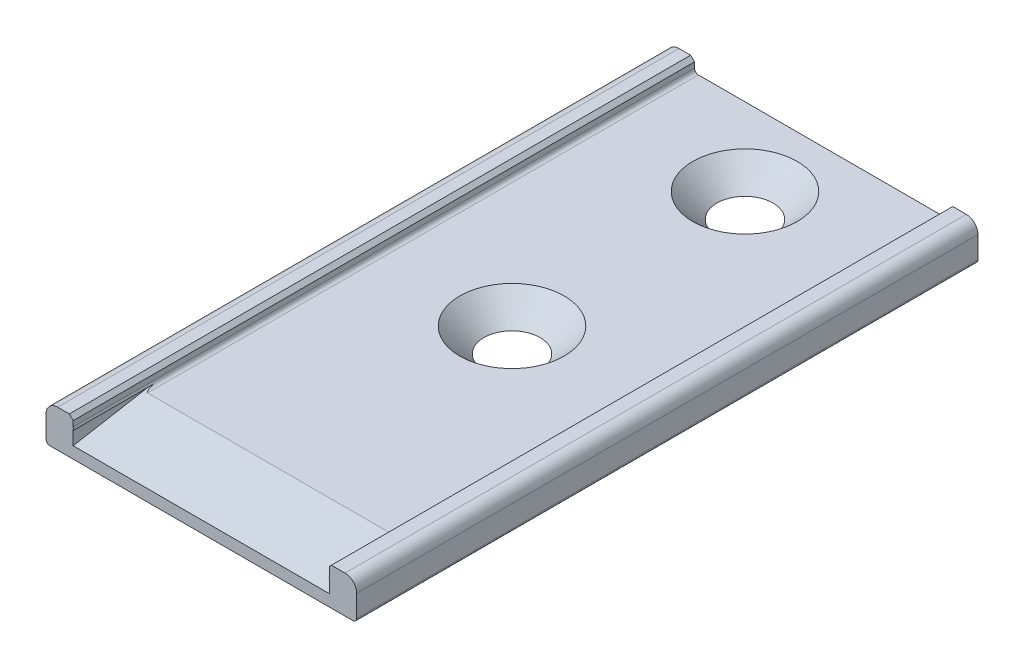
SolidWorks part; units mm, degrees
ref_plane "Front Plane" through (0, 0, 0) normal (0, 0, 1) x (1, 0, 0)
ref_plane "Top Plane" through (0, 0, 0) normal (0, 1, 0) x (1, 0, 0)
ref_plane "Right Plane" through (0, 0, 0) normal (1, 0, 0) x (0, 0, -1)
sketch "Sketch1" plane through (0, 0, 0) normal (0, 0, 1) x (1, 0, 0)
  line L0 (36.75, 4.8) -> (38.5, 4.8)
  line L1 (0.5, 0) -> (39.5, 0)
  line L2 (0, 0.5) -> (0, 3.3)
  line L3 (1.5, 4.8) -> (3, 4.8)
  line L4 (40, 0.5) -> (40, 3.3)
  line L6 (3.5, 4.3) -> (3.5, 3.6)
  line L7 (4, 3.1) -> (36, 3.1)
  line L8 (36.5, 4.55) -> (36.5, 3.6)
  line L9 (3, 4.8) -> (3.5, 4.3)
  line L10 (36.75, 4.8) -> (36.5, 4.55)
  arc A0 (38.5, 4.8) -> (40, 3.3) centre (38.5, 3.3) cw
  arc A1 (0, 3.3) -> (1.5, 4.8) centre (1.5, 3.3) cw
  arc A2 (39.5, 0) -> (40, 0.5) centre (39.5, 0.5) ccw
  arc A3 (0, 0.5) -> (0.5, 0) centre (0.5, 0.5) ccw
  arc A4 (36.5, 3.6) -> (36, 3.1) centre (36, 3.6) cw
  arc A5 (3.5, 3.6) -> (4, 3.1) centre (4, 3.6) ccw
  point P9 (3.5, 4.8)
  point P10 (36.5, 4.8)
  point P14 (0, 4.8)
  point P20 (40, 0)
  point P23 (0, 0)
  dimension "D6" = 1.5
  dimension "D2" = 0.5
  dimension "D7" = 0.5
  dimension "D1" = 40
  dimension "D3" = 3.5
  dimension "D4" = 4.8
  dimension "D5" = 3.1
  dimension "D10" = 33
extrude "Boss-Extrude1" add sketch "Sketch1" against normal blind 80
sketch "Sketch2" plane through (0, 0, 0) normal (0, 0, 1) x (1, 0, 0)
  line L0 (0.5, 0) -> (39.5, 0) construction
  line L1 (16, 0) -> (24, 0)
  line L2 (16, 0) -> (16, -2.75)
  line L3 (16.25, -3) -> (23.75, -3)
  line L4 (24, 0) -> (24, -2.75)
  line L5 (20, -3) -> (20, 4.8258) construction
  line L6 (0, 3.3) -> (0, 0.5) construction
  line L7 (16, -2.75) -> (16.25, -3)
  line L8 (23.75, -3) -> (24, -2.75)
  line L9 (40, 0.5) -> (40, 3.3) construction
  line L10 (38.5, 4.8) -> (36.75, 4.8) construction
  point P1 (24, -3)
  point P2 (16, -3)
  dimension "D1" = 3
  dimension "D2" = 8
  dimension "D3" = 4
  dimension "D4" = 20
extrude "Boss-Extrude2" [suppressed] add sketch "Sketch2" against normal through all
hole_wizard "CSK for M6 Hex Socket Countersunk Cap Screw1" positions "Sketch3" profile "Sketch4" countersink size "M6" standard "ISO"
sketch "Sketch3" plane through (0, 3.1, 0) normal (0, 1, 0) x (1, 0, 0)
  line L0 (0, 80) -> (0, 0) construction
  line L2 (36, 0) -> (4, 0) construction
  point P0 (20, 40)
  point P10 (20, 70)
  dimension "D1" = 20
  dimension "D2" = 40
  dimension "D3" = 30
sketch "Sketch4" plane through (20, 3.1, -40) normal (1, 0, 0) x (0, 0, 1)
  line L0 (0, 0) -> (0, 39.9828)
  line L1 (0, 39.9828) -> (3.3, 38)
  line L2 (3.3, 38) -> (3.3, 3.42)
  line L3 (3.3, 3.42) -> (6.72, 0)
  line L5 (6.72, 0) -> (0, 0)
  line L6 (-3.3, 3.42) -> (-6.72, 0) construction
  line L10 (0, 39.9828) -> (-3.3, 38) construction
  line L11 (0, -6.35) -> (0, 107.95) construction
  dimension "Hole Dia." = 6.6
  dimension "Hole Depth" = 38
  dimension "Near C'Sink Dia." = 13.44
  dimension "Near C'Sink Angle" = 90
  dimension "Drill Angle" = 118
pattern_linear "LPattern1" [suppressed] count 2 spacing 30
ref_plane "Plane1" through (20, 0, 0) normal (1, 0, 0) x (0, 0, -1)
sketch "Sketch5" plane through (20, 0, 0) normal (1, 0, 0) x (0, 0, -1)
  line L0 (0, 1.5) -> (10.2083, 3.3)
  line L1 (0, 0.5) -> (0, 3.3) construction
  line L2 (10.2083, 3.3) -> (-0.7961, 3.3)
  line L3 (-0.7961, 3.3) -> (-0.7961, 1.5)
  line L4 (-0.7961, 1.5) -> (0, 1.5)
  dimension "D1" = 1.5
  dimension "D2" = 10
  dimension "D3" = 1.8
extrude "Cut-Extrude1" cut sketch "Sketch5" against normal mid plane 33
